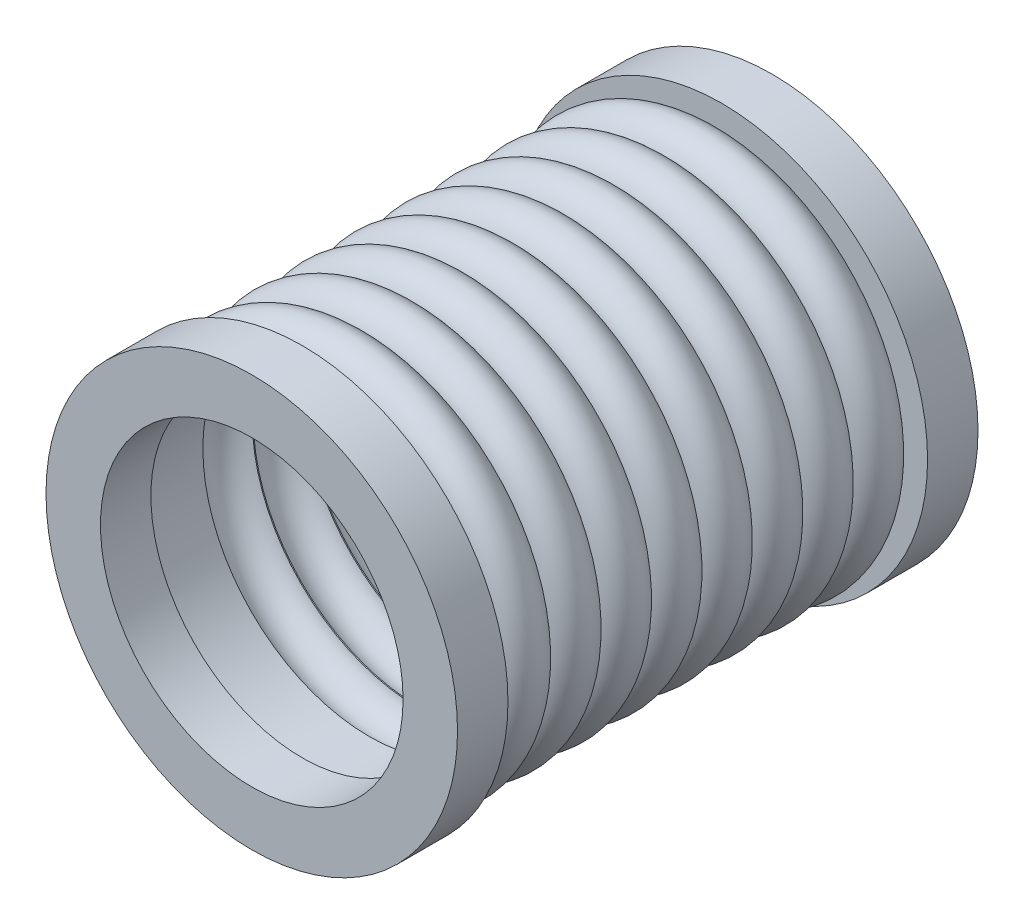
SolidWorks part; units mm, degrees
ref_plane "Front Plane" through (0, 0, 0) normal (0, 0, 1) x (1, 0, 0)
ref_plane "Top Plane" through (0, 0, 0) normal (0, 1, 0) x (1, 0, 0)
ref_plane "Right Plane" through (0, 0, 0) normal (1, 0, 0) x (0, 0, -1)
sketch "Sketch1" plane through (0, 0, 0) normal (0, 0, 1) x (1, 0, 0)
  line L0 (0, 76.5931) -> (0, -86.61) construction
  line L1 (-82.3345, 0) -> (103.59, 0) construction
  circle A0 centre (0, 0) radius 10.4775
  circle A1 centre (0, 0) radius 12.3825
  dimension "D1" = 24.765
  dimension "D2" = 20.955
extrude "Boss-Extrude1" add sketch "Sketch1" along normal blind 26.416
sketch "Sketch2" plane through (0, 0, 0) normal (0, 1, 0) x (1, 0, 0)
  line L0 (12.3825, 0) -> (-12.3825, 0) construction
  line L1 (12.3825, -26.416) -> (12.3825, 0) construction
  line L2 (0, 1.8698) -> (0, -32.5819) construction
  line L3 (10.795, 0) -> (13.335, 0)
  line L5 (10.795, -3.175) -> (13.335, -3.175)
  line L6 (13.335, 0) -> (13.335, -3.175)
  arc A0 (10.795, -3.175) -> (10.795, 0) centre (10.795, -1.5875) ccw
  dimension "D2" = 3.175
  dimension "D1" = 1.5875
  dimension "D3" = 2.54
  dimension "D4" = 3.175
revolve "Cut-Revolve2" cut sketch "Sketch2" angle 360 about L2
pattern_linear "LPattern2" count 9 spacing 3.175 along (0, 0, 1) of "Cut-Revolve2"
sketch "Sketch4" plane through (0, 0, 0) normal (0, 1, 0) x (1, 0, 0)
  line L1 (10.16, -3.175) -> (6.985, -3.175)
  line L2 (10.795, 0) -> (-10.795, 0) construction
  line L3 (10.16, 0) -> (6.985, 0)
  line L4 (6.985, -3.175) -> (6.985, 0)
  arc A0 (10.16, -3.175) -> (10.16, 0) centre (10.16, -1.5875) ccw
  arc A1 (10.795, -3.175) -> (10.795, 0) centre (10.795, -1.5875) ccw construction
  dimension "D1" = 3.175
  dimension "D5" = 0.635
  dimension "D2" = 1.5875
  dimension "D3" = 3.175
  dimension "D4" = 3.175
revolve "Cut-Revolve3" cut sketch "Sketch4" angle 360 about L2
pattern_linear "LPattern3" count 7 spacing 3.175 along (0, 0, 1) of "Cut-Revolve3"
sketch "Sketch6" [suppressed] plane through (0, 0, 0) normal (0, 1, 0) x (1, 0, 0)
  line L0 (-11.43, -17.145) -> (-12.3825, -15.24)
  line L2 (-11.43, -17.145) -> (-11.43, -21.59)
  line L3 (-11.43, -21.59) -> (-14.605, -21.59)
  line L4 (-14.605, -17.145) -> (-14.605, -21.59)
  line L5 (-12.3825, -15.24) -> (-12.3825, -19.05)
  line L6 (-12.3825, -19.05) -> (-13.6525, -19.05)
  line L7 (-13.6525, -19.05) -> (-13.6525, -15.24)
  line L8 (-14.605, -17.145) -> (-13.6525, -15.24)
  line L9 (-13.0175, -15.3829) -> (-13.0175, -21.9451) construction
  dimension "D1" = 1.27
  dimension "D2" = 3.81
  dimension "D3" = 3.175
  dimension "D4" = 1.905
  dimension "D5" = 6.35
revolve "Revolve1" [suppressed] add sketch "Sketch6" angle 360 about L2
sketch "Sketch7" plane through (0, 0, 0) normal (0, 0, -1) x (-1, 0, 0)
  circle A0 centre (0, 0) radius 9.525
  circle A1 centre (0, 0) radius 12.954
  dimension "D1" = 19.05
  dimension "D2" = 25.908
extrude "Boss-Extrude2" add sketch "Sketch7" along normal blind 3.175
sketch "Sketch8" plane through (0, 0, 26.416) normal (0, 0, 1) x (1, 0, 0)
  circle A0 centre (0, 0) radius 12.954
  circle A1 centre (0, 0) radius 9.525
  dimension "D1" = 19.05
  dimension "D2" = 25.908
extrude "Boss-Extrude3" add sketch "Sketch8" along normal blind 3.175
